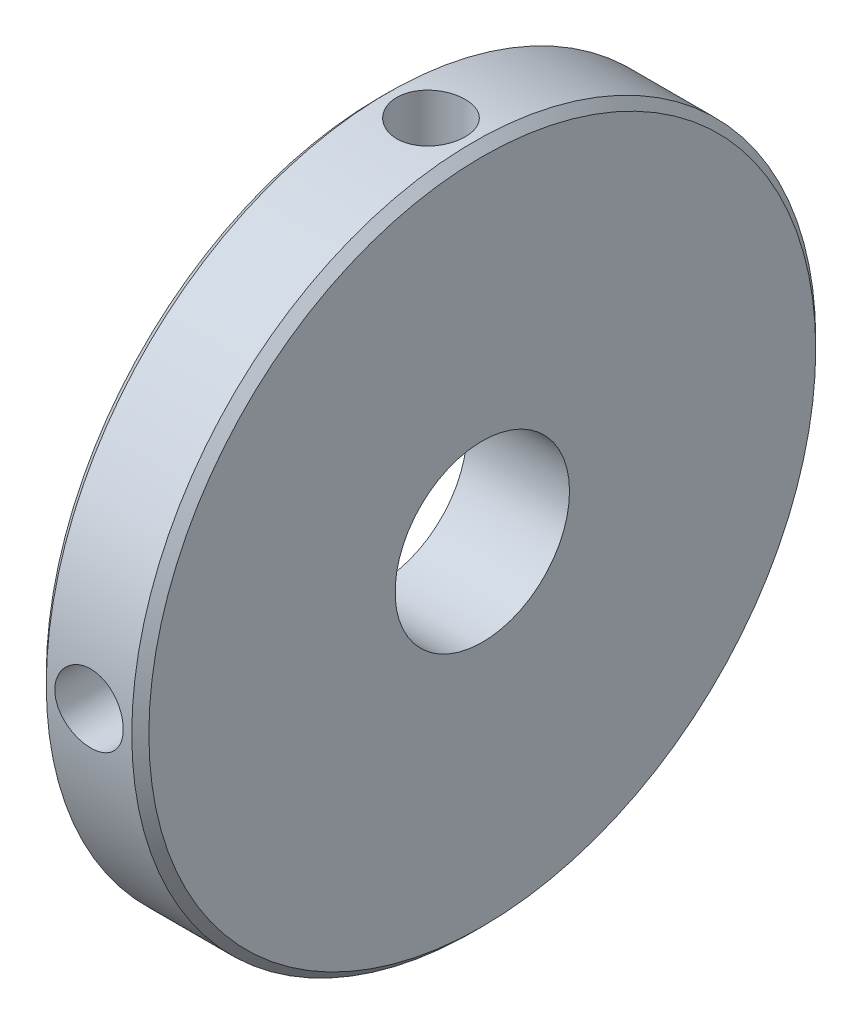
SolidWorks part; units mm, degrees
ref_plane "Face" through (0, 0, 0) normal (0, 0, 1) x (1, 0, 0)
ref_plane "Dessus" through (0, 0, 0) normal (0, 1, 0) x (1, 0, 0)
ref_plane "Droite" through (0, 0, 0) normal (1, 0, 0) x (0, 0, -1)
sketch "Esquisse1" plane through (0, 0, 0) normal (0, 0, 1) x (1, 0, 0)
  line L0 (-6.2215, 0) -> (35.632, 0) construction
  line L1 (0, 0) -> (6, 0)
  line L2 (0, 0) -> (0, 20)
  line L3 (0, 20) -> (6, 20)
  line L4 (6, 0) -> (6, 20)
  dimension "D1" = 20
  dimension "D2" = 6
revolve "Base-Révolution" add sketch "Esquisse1" angle 360 about L0
chamfer "Chanfrein1" distance 0.5 angle 45 2 edges at (6, 0, 20) (0, 0, 20)
sketch "Esquisse2" plane through (0, 0, 0) normal (0, 0, 1) x (1, 0, 0)
  line L0 (5.5, 20) -> (0.5, 20) construction
  line L1 (5, 20) -> (3, 20)
  line L2 (5, 20) -> (5, 15)
  line L3 (5, 15) -> (3, 13.7983)
  line L4 (3, 13.7983) -> (3, 20)
  line L5 (3, 20) -> (3, 12.9338) construction
  dimension "D1" = 2
  dimension "D2" = 59
  dimension "D3" = 5
  dimension "D4" = 3
revolve "Trou radial" cut sketch "Esquisse2" angle 360 about L5
ref_axis "Axe de révolution" through (43.7785, 0, 0) along (-1, 0, 0)
pattern_circular "Répétition circulaire1" count 4 over 360 about axis through (43.7785, 0, 0) along (-1, 0, 0) of "Trou radial"
hole_wizard "Trou taraudé M12x1.752" positions "Esquisse6" profile "Esquisse5" tap size "M12x1.75" standard "ISO"
sketch "Esquisse6" plane through (6, 0, 0) normal (1, 0, 0) x (0, 0, -1)
  circle A0 centre (0, 0) radius 19.5 construction
  point P0 (0, 0)
sketch "Esquisse5" plane through (6, 0, 0) normal (0, 1, 0) x (0, 0, -1)
  line L0 (0, 0) -> (0, 6)
  line L1 (0, 6) -> (5.1, 6)
  line L2 (5.1, 6) -> (5.1, 0)
  line L5 (5.1, 0) -> (0, 0)
  line L11 (0, -6.35) -> (0, 107.95) construction
  dimension "Diamètre du perçage jusqu'au prochain" = 10.2
  dimension "Profondeur du perçage jusqu'au prochain" = 6
equation "\"D4@Esquisse2\" = \"D2@Esquisse1\"/2"
